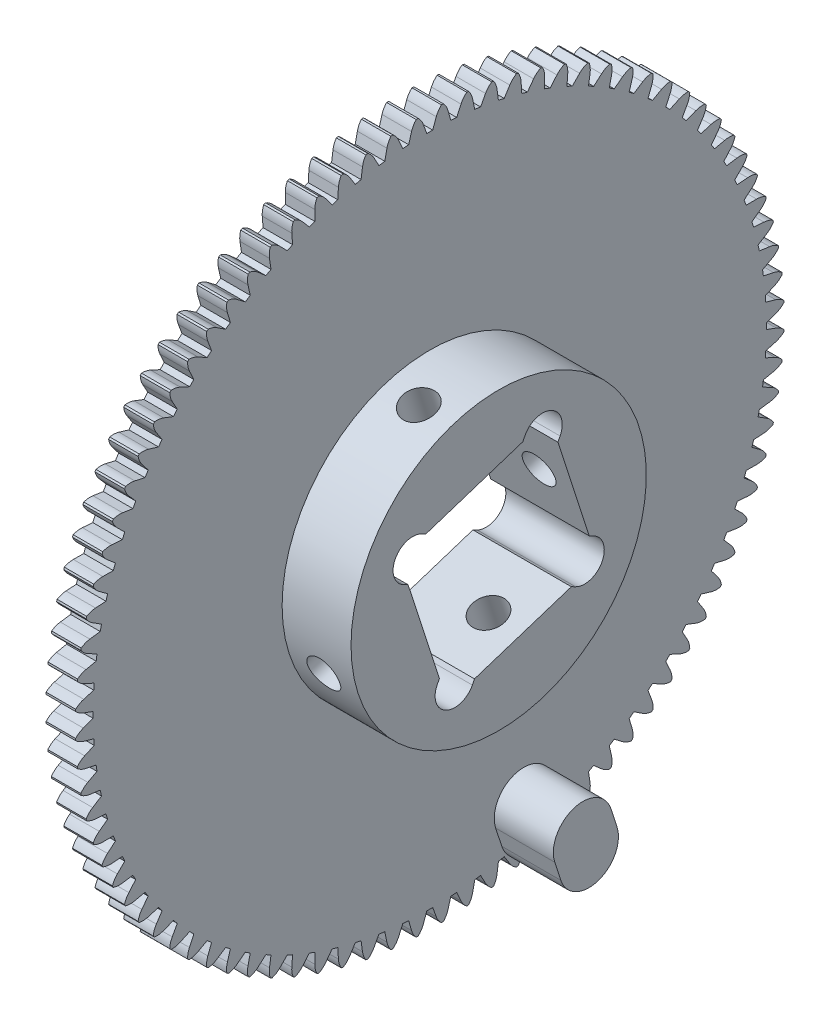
SolidWorks part; units mm, degrees
ref_plane "Plan de face" through (0, 0, 0) normal (0, 0, 1) x (1, 0, 0)
ref_plane "Plan de dessus" through (0, 0, 0) normal (0, 1, 0) x (1, 0, 0)
ref_plane "Plan de droite" through (0, 0, 0) normal (1, 0, 0) x (0, 0, -1)
sketch "Esquisse1" plane through (0, 0, 0) normal (0, 0, 1) x (1, 0, 0)
  line L0 (-19.4483, 0) -> (45.9971, 0) construction
  line L2 (0, 15) -> (3, 15)
  line L3 (0, 15) -> (0, 36)
  line L4 (0, 36) -> (3, 36)
  line L5 (3, 15) -> (3, 36)
  dimension "D1" = 15
  dimension "D2" = 3
  dimension "D4" = 36
revolve "Révolution1" add sketch "Esquisse1" angle 360 about L0
sketch "Esquisse2" plane through (0, 0, 0) normal (-1, 0, 0) x (0, 0, 1)
  line L0 (0, 17.9781) -> (0, -0.7899) construction
  line L1 (-2.5415, 36.5097) -> (2.5415, 36.5097)
  line L2 (0.6621, 35.1938) -> (0.3, 34.1988)
  line L3 (0.3, 34.1988) -> (-0.3, 34.1988)
  line L4 (-0.3, 34.1988) -> (-0.6621, 35.1938)
  arc A0 (2.5415, 36.5097) -> (0.6621, 35.1938) centre (2.5415, 34.5097) ccw
  circle A1 centre (0, 0) radius 35.2 construction
  arc A2 (-0.6621, 35.1938) -> (-2.5415, 36.5097) centre (-2.5415, 34.5097) ccw
  dimension "D6" = 70.4
  dimension "D3" = 4
  dimension "D1" = 70
  dimension "D2" = 70
  dimension "D5" = 0.3
extrude "Enlèv. mat.-Extru.1" cut sketch "Esquisse2" against normal through all
pattern_circular "Répétition circulaire1" count 88 over 360 about axis through (0, 0, 0) along (1, 0, 0) of "Enlèv. mat.-Extru.1"
sketch "Esquisse3" plane through (0, 0, 0) normal (-1, 0, 0) x (0, 0, 1)
  line L1 (-9.2044, -2.4546) -> (-9.6375, -2.6757) construction
  line L2 (-7.8183, -6.2381) -> (-7.3852, -6.017) construction
  line L3 (-7.3852, -6.017) -> (2.4546, -9.2044) construction
  line L4 (7.3852, 6.017) -> (-2.4546, 9.2044) construction
  line L5 (-9.2044, -2.4546) -> (-9.6375, -2.6757)
  line L6 (-7.8183, -6.2381) -> (-7.3852, -6.017)
  line L7 (-7.3852, -6.017) -> (2.4546, -9.2044)
  line L8 (7.3852, 6.017) -> (-2.4546, 9.2044)
  line L9 (-2.4653, -7.6107) -> (2.4653, 7.6107) construction
  line L10 (-6.263, 2.0288) -> (9.5046, -3.0788) construction
  line L11 (-2.6757, 9.6375) -> (-2.4546, 9.2044)
  line L12 (-6.017, 7.3852) -> (-6.2381, 7.8183)
  line L13 (-6.017, 7.3852) -> (-9.2044, -2.4546)
  line L14 (9.2044, 2.4546) -> (6.017, -7.3852)
  line L15 (9.2044, 2.4546) -> (9.6375, 2.6757)
  line L16 (7.8183, 6.2381) -> (7.3852, 6.017)
  line L17 (2.6757, -9.6375) -> (2.4546, -9.2044)
  line L18 (6.017, -7.3852) -> (6.2381, -7.8183)
  arc A0 (-9.6375, -2.6757) -> (-7.8183, -6.2381) centre (-8.7279, -4.4569) ccw construction
  arc A1 (6.2381, -7.8183) -> (2.6757, -9.6375) centre (4.4569, -8.7279) cw
  arc A2 (9.6375, 2.6757) -> (7.8183, 6.2381) centre (8.7279, 4.4569) ccw
  arc A3 (-9.6375, -2.6757) -> (-7.8183, -6.2381) centre (-8.7279, -4.4569) ccw
  arc A4 (-6.2381, 7.8183) -> (-2.6757, 9.6375) centre (-4.4569, 8.7279) cw
  circle A5 centre (0, 0) radius 15
  dimension "D1" = 30
extrude "Boss.-Extru.1" add sketch "Esquisse3" against normal blind 10
hole_wizard "Trou taraudé M41" positions "Esquisse5" profile "Esquisse4" tap size "M4" standard "ISO"
sketch "Esquisse5" plane through (0, 2.4653, -7.6107) normal (0, -0.3082, 0.9513) x (1, 0, 0)
  line L0 (-2.2162, 0) -> (17.7349, 0) construction
  line L1 (10, 5.1716) -> (10, -5.1716) construction
  point P0 (6.5, 0)
  dimension "D1" = 3.5
sketch "Esquisse4" plane through (6.5, 2.4653, -7.6107) normal (1, 0, 0) x (0, -0.9513, -0.3082)
  line L0 (0, 0) -> (0, 37.3173)
  line L1 (0, 37.3173) -> (1.65, 37.3173)
  line L2 (1.65, 37.3173) -> (1.65, 0)
  line L5 (1.65, 0) -> (0, 0)
  line L11 (0, -6.35) -> (0, 107.95) construction
  dimension "Diamètre du trou pour taraudage jusqu'au prochain" = 3.3
  dimension "Profondeur du trou pour taraudage jusqu'au prochain" = 37.3173
pattern_circular "Répétition circulaire2" count 4 over 360 about axis through (10, 0, 0) along (-1, 0, 0) of "Trou taraudé M41"
sketch "Esquisse6" plane through (3, 0, 0) normal (1, 0, 0) x (0, 0, -1)
  line L0 (0, 0) -> (12.7873, -39.4753) construction
  line L1 (-7.3852, 6.017) -> (2.4546, 9.2044) construction
  line L2 (10.1695, -31.394) -> (9.5532, -29.4913) construction
  line L3 (7.3155, -32.3185) -> (6.6992, -30.4158)
  line L4 (13.0235, -30.4695) -> (12.4072, -28.5668)
  circle A0 centre (0, 0) radius 36 construction
  arc A1 (7.3155, -32.3185) -> (13.0235, -30.4695) centre (10.1695, -31.394) ccw
  arc A2 (12.4072, -28.5668) -> (6.6992, -30.4158) centre (9.5532, -29.4913) ccw
  point P8 (9.8613, -30.4426)
  dimension "D3" = 2
  dimension "D1" = 72
  dimension "D2" = 3
extrude "Boss.-Extru.2" add sketch "Esquisse6" along normal blind 6
